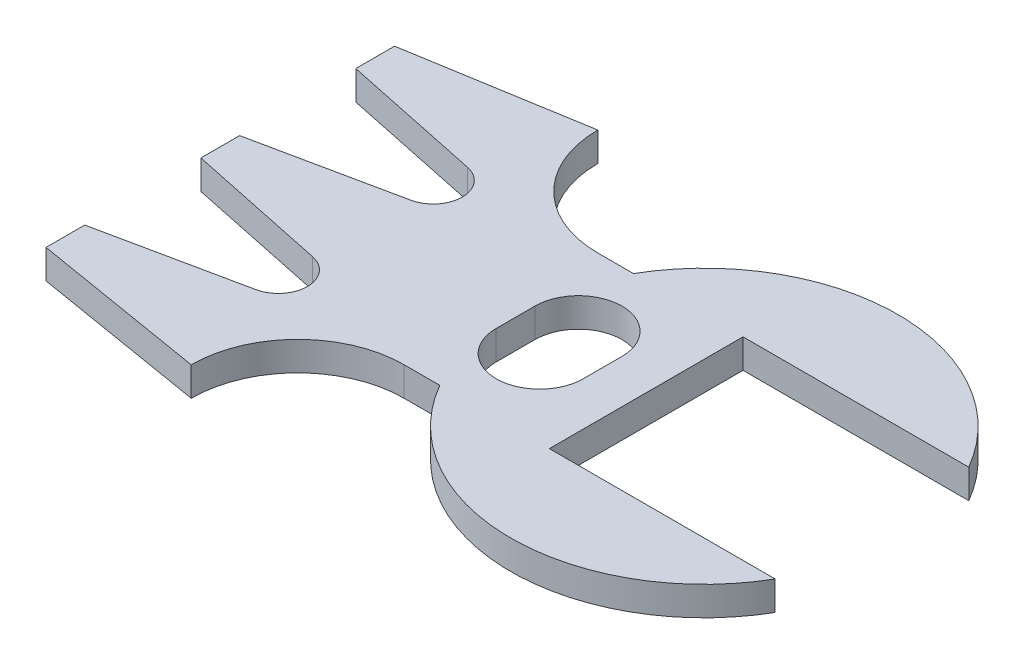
SolidWorks part; units mm, degrees
ref_plane "Front Plane" through (0, 0, 0) normal (0, 0, 1) x (1, 0, 0)
ref_plane "Top Plane" through (0, 0, 0) normal (0, 1, 0) x (1, 0, 0)
ref_plane "Right Plane" through (0, 0, 0) normal (1, 0, 0) x (0, 0, -1)
sketch "Sketch1" plane through (0, 0, 0) normal (0, 1, 0) x (1, 0, 0)
  line L0 (14, 45) -> (14, 0) construction
  line L1 (39.5, 23) -> (39.5, 19)
  line L2 (0, 3) -> (0, 7)
  line L3 (67.3205, 31) -> (44, 31)
  line L4 (44, 31) -> (44, 11)
  line L5 (18, 42) -> (0, 39)
  line L6 (18, 42) -> (18, 0) construction
  line L7 (18, 0) -> (0, 3)
  line L8 (0, 0) -> (0, 3) construction
  line L9 (0, 0) -> (18, 0) construction
  line L10 (75, 21) -> (18, 21) construction
  line L11 (0, 35) -> (14.6155, 31.9362)
  line L12 (0, 23) -> (14.6155, 26.0638)
  line L13 (0, 19) -> (14.6155, 15.9362)
  line L14 (0, 7) -> (14.6155, 10.0638)
  line L15 (0, 19) -> (0, 23)
  line L16 (0, 35) -> (0, 39)
  line L17 (29, 31) -> (32.6795, 31)
  line L18 (29, 11) -> (32.6795, 11)
  line L19 (30.5, 23) -> (30.5, 19)
  line L20 (44, 11) -> (67.3205, 11)
  line L21 (18, 42) -> (29, 42) construction
  line L22 (35, 23) -> (35, 19) construction
  line L23 (18, 0) -> (29, 0) construction
  line L24 (18, 21) -> (0, 21) construction
  arc A0 (14.6155, 26.0638) -> (14.6155, 31.9362) centre (14, 29) ccw
  arc A1 (14.6155, 10.0638) -> (14.6155, 15.9362) centre (14, 13) ccw
  arc A2 (67.3205, 31) -> (32.6795, 31) centre (50, 21) ccw
  arc A3 (18, 42) -> (29, 31) centre (29, 42) ccw
  arc A4 (39.5, 23) -> (30.5, 23) centre (35, 23) ccw
  arc A5 (30.5, 19) -> (39.5, 19) centre (35, 19) ccw
  arc A6 (32.6795, 11) -> (67.3205, 11) centre (50, 21) ccw
  arc A7 (29, 11) -> (18, 0) centre (29, 0) ccw
  dimension "D1" = 6
  dimension "D2" = 6
  dimension "D5" = 8
  dimension "D6" = 8
  dimension "D14" = 22
  dimension "D15" = 10
  dimension "D16" = 9
  dimension "D17" = 9
  dimension "D20" = 40
  dimension "D21" = 21
  dimension "D22" = 10
  dimension "D25" = 11
  dimension "D3" = 14
  dimension "D4" = 4
  dimension "D7" = 42
  dimension "D8" = 12
  dimension "D9" = 11
  dimension "D10" = 4
  dimension "D11" = 4
  dimension "D12" = 4
  dimension "D13" = 12
  dimension "D18" = 2
  dimension "D19" = 2
  dimension "D23" = 6
  dimension "D24" = 15
extrude "Extrude1" add sketch "Sketch1" along normal blind 3
